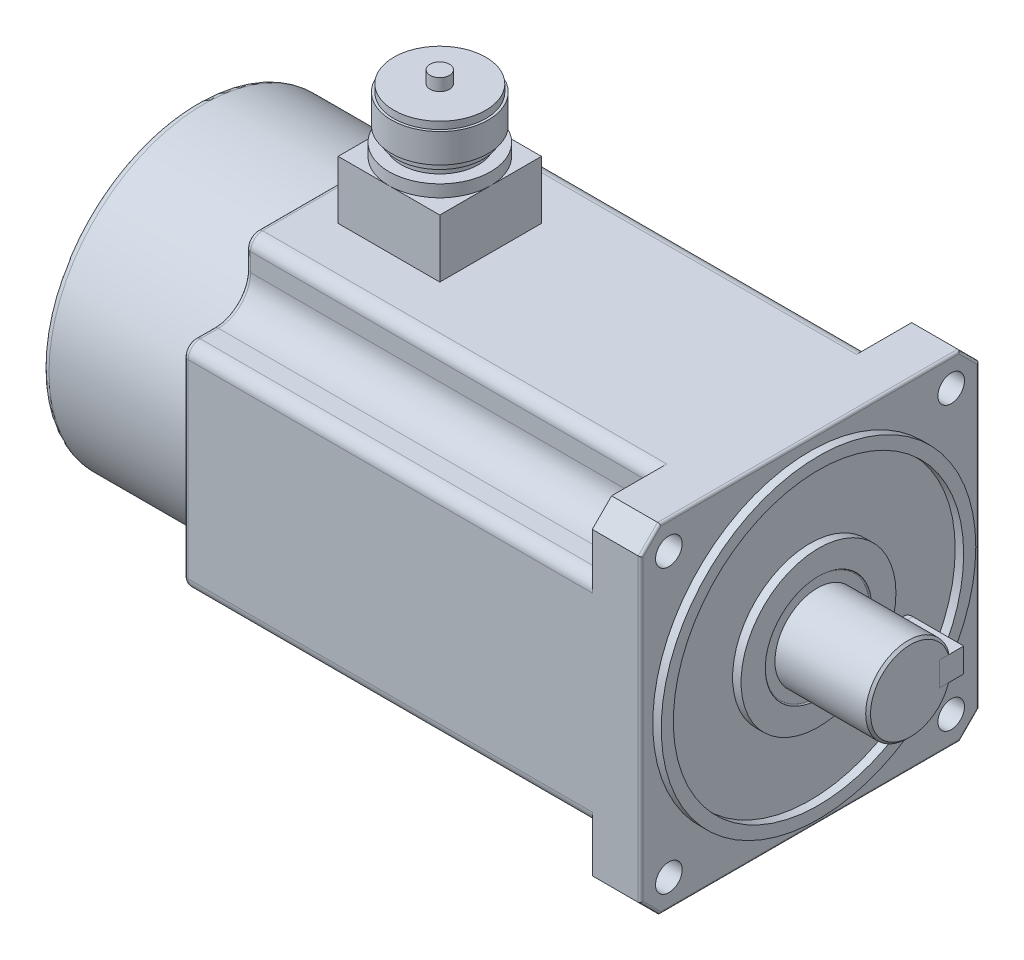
SolidWorks part; units mm, degrees
ref_plane "前视基准面" through (0, 0, 0) normal (0, 0, 1) x (1, 0, 0)
ref_plane "上视基准面" through (0, 0, 0) normal (0, 1, 0) x (1, 0, 0)
ref_plane "右视基准面" through (0, 0, 0) normal (1, 0, 0) x (0, 0, -1)
sketch "草图1" plane through (0, 0, 0) normal (1, 0, 0) x (0, 0, -1)
  line L0 (-70, 62) -> (-62, 70)
  line L1 (-62, -70) -> (62, -70)
  line L2 (-70, -62) -> (-70, 62)
  line L3 (-62, 70) -> (62, 70)
  line L4 (70, -62) -> (70, 62)
  line L5 (-70, -70) -> (70, 70) construction
  line L6 (-70, 70) -> (70, -70) construction
  line L7 (-62, -70) -> (-70, -62)
  line L8 (62, -70) -> (70, -62)
  line L9 (70, 62) -> (62, 70)
  point P0 (0, 0)
extrude "凸台-拉伸1" add sketch "草图1" against normal blind 189
sketch "草图2" plane through (-189, 0, 0) normal (-1, 0, 0) x (0, 0, 1)
  line L0 (-57.5, 44.2147) -> (-65, 44.2147)
  line L1 (-70, -62) -> (-70, 62) construction
  line L3 (-65, -44.2147) -> (-57.5, -44.2147)
  line L4 (-70, 39.2147) -> (-70, 62)
  line L5 (-44.2147, -57.5) -> (-44.2147, -65)
  line L6 (62, -70) -> (-62, -70) construction
  line L8 (44.2147, -65) -> (44.2147, -57.5)
  line L9 (-70, 62) -> (-62, 70)
  line L10 (57.5, -44.2147) -> (65, -44.2147)
  line L11 (70, 62) -> (70, -62) construction
  line L13 (65, 44.2147) -> (57.5, 44.2147)
  line L14 (-62, 70) -> (-39.2147, 70)
  line L15 (44.2147, 57.5) -> (44.2147, 65)
  line L16 (-62, 70) -> (62, 70) construction
  line L18 (-44.2147, 65) -> (-44.2147, 57.5)
  line L19 (39.2147, 70) -> (62, 70)
  line L20 (62, 70) -> (70, 62)
  line L21 (70, 62) -> (70, 39.2147)
  line L22 (70, -39.2147) -> (70, -62)
  line L23 (70, -62) -> (62, -70)
  line L24 (62, -70) -> (39.2147, -70)
  line L25 (-39.2147, -70) -> (-62, -70)
  line L26 (-62, -70) -> (-70, -62)
  line L27 (-70, -62) -> (-70, -39.2147)
  arc A0 (-57.5, 44.2147) -> (-44.2147, 57.5) centre (-57.5, 57.5) ccw
  arc A1 (44.2147, 57.5) -> (57.5, 44.2147) centre (57.5, 57.5) ccw
  arc A2 (57.5, -44.2147) -> (44.2147, -57.5) centre (57.5, -57.5) ccw
  arc A3 (-44.2147, -57.5) -> (-57.5, -44.2147) centre (-57.5, -57.5) ccw
  arc A4 (-65, 44.2147) -> (-70, 39.2147) centre (-65, 39.2147) ccw
  arc A5 (-70, -39.2147) -> (-65, -44.2147) centre (-65, -39.2147) ccw
  arc A6 (-44.2147, -65) -> (-39.2147, -70) centre (-39.2147, -65) ccw
  arc A7 (39.2147, -70) -> (44.2147, -65) centre (39.2147, -65) ccw
  arc A8 (65, -44.2147) -> (70, -39.2147) centre (65, -39.2147) ccw
  arc A9 (70, 39.2147) -> (65, 44.2147) centre (65, 39.2147) ccw
  arc A10 (44.2147, 65) -> (39.2147, 70) centre (39.2147, 65) ccw
  arc A11 (-39.2147, 70) -> (-44.2147, 65) centre (-39.2147, 65) ccw
  point P0 (0, 0)
  point P10 (-70, 44.2147)
  point P39 (-70, -44.2147)
  point P42 (-44.2147, -70)
  point P45 (44.2147, -70)
  point P48 (70, -44.2147)
  point P51 (70, 44.2147)
  point P54 (44.2147, 70)
  point P57 (-44.2147, 70)
  dimension "D1" = 5
extrude "切除-拉伸1" cut sketch "草图2" against normal blind 169
fillet "圆角1" radius 2 24 edges at (-189, 48.1059, 48.1059) (-189, 44.2147, 61.25) (-189, 42.7502, 68.5355) (-189, 0, 70) (-189, -42.7502, 68.5355) (-189, -44.2147, 61.25) (-189, -48.1059, 48.1059) (-189, -61.25, 44.2147) (-189, -68.5355, 42.7502) (-189, -70, 0) (-189, -68.5355, -42.7502) (-189, -61.25, -44.2147) (-189, -48.1059, -48.1059) (-189, -44.2147, -61.25) (-189, -42.7502, -68.5355) (-189, 0, -70) (-189, 42.7502, -68.5355) (-189, 44.2147, -61.25) (-189, 48.1059, -48.1059) (-189, 61.25, -44.2147) (-189, 68.5355, -42.7502) (-189, 70, 0) (-189, 68.5355, 42.7502) (-189, 61.25, 44.2147)
fillet "圆角2" radius 1 8 edges at (0, 66, -66) (0, 0, -70) (0, -66, -66) (0, -70, 0) (0, -66, 66) (0, 0, 70) (0, 66, 66) (0, 70, 0)
sketch "草图4" plane through (0, 0, 0) normal (1, 0, 0) x (0, 0, -1)
  circle A1 centre (-58.3363, 58.3363) radius 5.5
  circle A2 centre (58.3363, 58.3363) radius 5.5
  circle A3 centre (58.3363, -58.3363) radius 5.5
  circle A4 centre (-58.3363, -58.3363) radius 5.5
extrude "切除-拉伸2" cut sketch "草图4" against normal blind 20
sketch "草图5" plane through (0, 0, 0) normal (1, 0, 0) x (0, 0, -1)
  circle A0 centre (0, 0) radius 60
  circle A1 centre (0, 0) radius 65
extrude "凸台-拉伸2" add sketch "草图5" along normal blind 3.5
sketch "草图6" plane through (0, 0, 0) normal (1, 0, 0) x (0, 0, -1)
  circle A0 centre (0, 0) radius 32
extrude "凸台-拉伸3" add sketch "草图6" along normal blind 3.5
sketch "草图7" plane through (3.5, 0, 0) normal (1, 0, 0) x (0, 0, -1)
  circle A0 centre (0, 0) radius 22
extrude "切除-拉伸3" cut sketch "草图7" against normal blind 0.5
fillet "圆角3" radius 0.5 1 edges at (3, 0, -22)
sketch "草图8" plane through (3, 0, 0) normal (1, 0, 0) x (0, 0, -1)
  circle A0 centre (0, 0) radius 17.5
extrude "凸台-拉伸4" add sketch "草图8" along normal blind 38.5
ref_plane "基准面1" through (0, 0, -17.5) normal (0, 0, 1) x (1, 0, 0)
sketch "草图9" plane through (0, 0, -17.5) normal (0, 0, 1) x (1, 0, 0)
  line L1 (41.5, -17.5) -> (41.5, 17.5) construction
  line L2 (20.5, 5) -> (41.5, 5)
  line L3 (41.5, 5) -> (41.5, -5)
  line L4 (41.5, -5) -> (20.5, -5)
  arc A0 (20.5, 5) -> (20.5, -5) centre (20.5, 0) ccw
extrude "切除-拉伸4" cut sketch "草图9" along normal blind 5.5
sketch "草图10" plane through (0, 0, -12) normal (0, 0, -1) x (-1, 0, 0)
  line L0 (-20.5, 5) -> (-41.5, 5)
  line L1 (-41.5, 5) -> (-41.5, -5)
  line L2 (-41.5, -5) -> (-20.5, -5)
  arc A0 (-20.5, -5) -> (-20.5, 5) centre (-20.5, 0) ccw
extrude "凸台-拉伸5" add sketch "草图10" along normal blind 10 separate body
sketch "草图11" plane through (-189, 0, 0) normal (-1, 0, 0) x (0, 0, 1)
  circle A0 centre (0, 0) radius 64
extrude "凸台-拉伸6" add sketch "草图11" along normal blind 64.5
fillet "圆角4" radius 3 1 edges at (-253.5, 0, 64)
chamfer "倒角1" distance 1 angle 45 1 edges at (41.5, 0, 17.5)
sketch "草图12" plane through (0, 70, 0) normal (0, 1, 0) x (1, 0, 0)
  line L3 (-174, -21) -> (-132, -21)
  line L4 (-174, -21) -> (-174, 21)
  line L5 (-174, 21) -> (-132, 21)
  line L6 (-132, -21) -> (-132, 21)
  line L7 (-174, -21) -> (-132, 21) construction
  line L8 (-174, 21) -> (-132, -21) construction
extrude "凸台-拉伸7" add sketch "草图12" along normal blind 24
sketch "草图13" plane through (0, 94, 0) normal (0, 1, 0) x (1, 0, 0)
  circle A0 centre (-153, 0) radius 21
extrude "凸台-拉伸8" add sketch "草图13" along normal blind 5
sketch "草图14" plane through (0, 99, 0) normal (0, 1, 0) x (1, 0, 0)
  circle A0 centre (-153, 0) radius 16
extrude "凸台-拉伸9" add sketch "草图14" along normal blind 3
sketch "草图15" plane through (0, 102, 0) normal (0, 1, 0) x (1, 0, 0)
  circle A0 centre (-153, 0) radius 18
extrude "凸台-拉伸10" add sketch "草图15" along normal blind 3
sketch "草图16" plane through (0, 105, 0) normal (0, 1, 0) x (1, 0, 0)
  circle A0 centre (-153, 0) radius 20
extrude "凸台-拉伸11" add sketch "草图16" along normal blind 12
sketch "草图17" plane through (0, 117, 0) normal (0, 1, 0) x (1, 0, 0)
  circle A0 centre (-153, 0) radius 19
extrude "凸台-拉伸12" add sketch "草图17" along normal blind 3
sketch "草图18" plane through (0, 120, 0) normal (0, 1, 0) x (1, 0, 0)
  circle A0 centre (-153, 0) radius 4
extrude "凸台-拉伸13" add sketch "草图18" along normal blind 5
